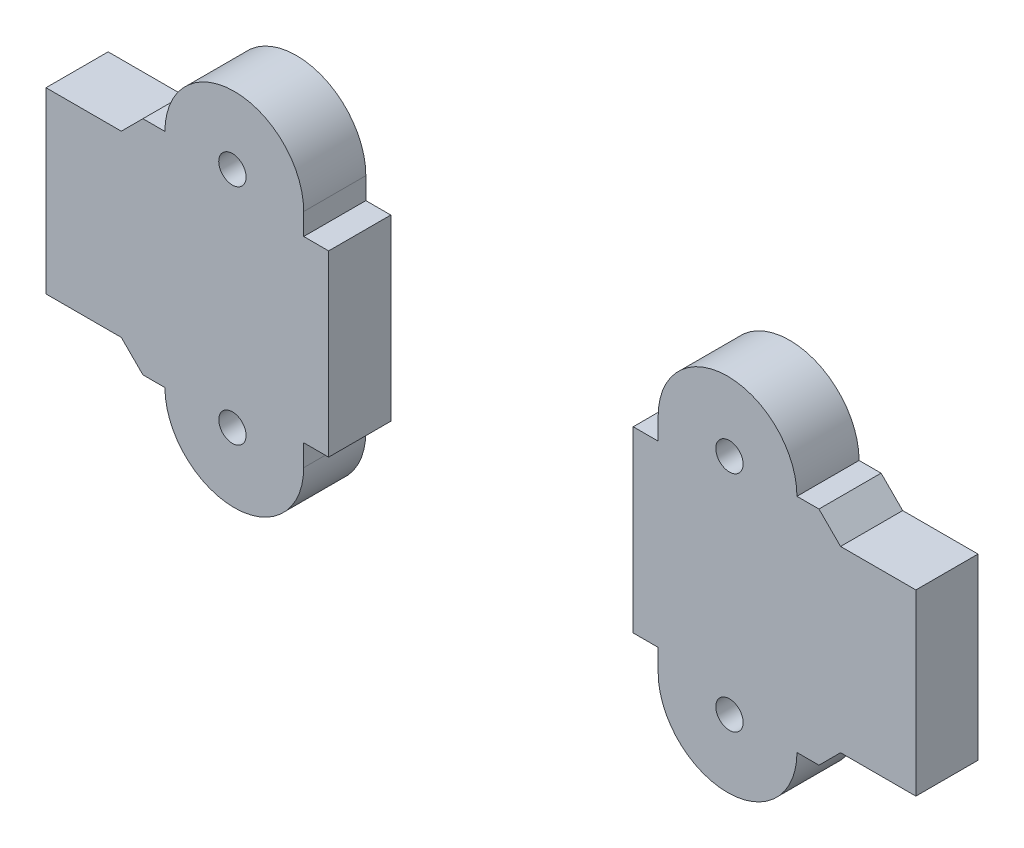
SolidWorks part; units mm, degrees
ref_plane "Front Plane" through (0, 0, 0) normal (0, 0, 1) x (1, 0, 0)
ref_plane "Top Plane" through (0, 0, 0) normal (0, 1, 0) x (1, 0, 0)
ref_plane "Right Plane" through (0, 0, 0) normal (1, 0, 0) x (0, 0, -1)
sketch "Sketch1" plane through (0, 0, 0) normal (0, 0, 1) x (1, 0, 0)
  line L0 (-35, -15) -> (0, -15) construction
  line L1 (-35, 5) -> (-35, -35) construction
  line L2 (0, 0) -> (0, -28.9769) construction
  line L3 (-35, -22.1868) -> (-28.9407, -22.1868)
  line L4 (-28.9407, -22.1868) -> (-27.2014, -23.9262)
  line L5 (-27.2014, -23.9262) -> (-25.4309, -23.9262)
  line L6 (-14.2615, -23.9262) -> (-14.2615, -22.1868)
  line L7 (-14.2615, -22.1868) -> (-12.255, -22.1868)
  line L8 (-12.255, -22.1868) -> (-12.255, -7.8132)
  line L9 (-14.2615, -7.8132) -> (-12.255, -7.8132)
  line L10 (-14.2615, -6.0738) -> (-14.2615, -7.8132)
  line L11 (-27.2014, -6.0738) -> (-25.4309, -6.0738)
  line L12 (-28.9407, -7.8132) -> (-27.2014, -6.0738)
  line L13 (-35, -7.8132) -> (-28.9407, -7.8132)
  line L14 (-35, -7.8132) -> (-35, -22.1868)
  line L15 (35, -7.8132) -> (28.9407, -7.8132)
  line L16 (28.9407, -7.8132) -> (27.2014, -6.0738)
  line L17 (27.2014, -6.0738) -> (25.4309, -6.0738)
  line L18 (14.2615, -6.0738) -> (14.2615, -7.8132)
  line L19 (14.2615, -7.8132) -> (12.255, -7.8132)
  line L20 (12.255, -22.1868) -> (12.255, -7.8132)
  line L21 (14.2615, -22.1868) -> (12.255, -22.1868)
  line L22 (14.2615, -23.9262) -> (14.2615, -22.1868)
  line L23 (27.2014, -23.9262) -> (25.4309, -23.9262)
  line L24 (28.9407, -22.1868) -> (27.2014, -23.9262)
  line L25 (35, -22.1868) -> (28.9407, -22.1868)
  line L26 (35, -7.8132) -> (35, -22.1868)
  arc A0 (-25.4309, -23.9262) -> (-14.2615, -23.9262) centre (-19.8462, -23.9262) ccw
  circle A2 centre (-20, -24) radius 1.1
  circle A3 centre (-20, -6) radius 1.1
  arc A4 (-25.4309, -6.0738) -> (-14.2615, -6.0738) centre (-19.8462, -6.0738) cw
  circle A5 centre (20, -6) radius 1.1
  circle A6 centre (20, -24) radius 1.1
  arc A7 (25.4309, -6.0738) -> (14.2615, -6.0738) centre (19.8462, -6.0738) ccw
  arc A8 (25.4309, -23.9262) -> (14.2615, -23.9262) centre (19.8462, -23.9262) cw
  point P22 (-12.255, -15)
  dimension "D1" = 2.2
extrude "Boss-Extrude2" add sketch "Sketch1" along normal blind 5
